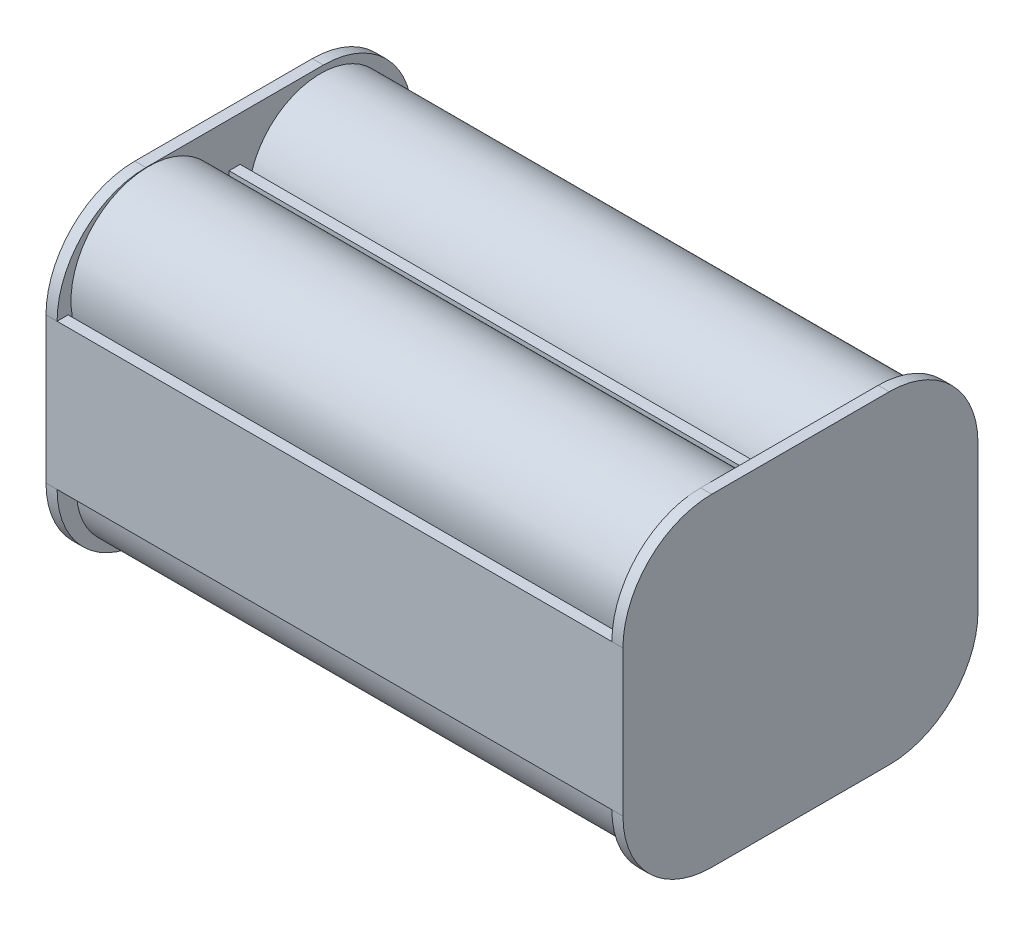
SolidWorks part; units mm, degrees
ref_plane "Plano frontal" through (0, 0, 0) normal (0, 0, 1) x (1, 0, 0)
ref_plane "Plano superior" through (0, 0, 0) normal (0, 1, 0) x (1, 0, 0)
ref_plane "Plano direito" through (0, 0, 0) normal (1, 0, 0) x (0, 0, -1)
sketch "Esboço1" plane through (0, 0, 0) normal (1, 0, 0) x (0, 0, -1)
  line L1 (-5.3034, 18.6966) -> (10.6966, 18.6966)
  line L2 (-13.3034, 10.6966) -> (-13.3034, -2.427)
  line L3 (-5.3034, -10.427) -> (10.6966, -10.427)
  line L4 (18.6966, 10.6966) -> (18.6966, -2.427)
  arc A0 (-5.3034, 18.6966) -> (-13.3034, 10.6966) centre (-5.3034, 10.6966) ccw
  arc A1 (10.6966, 18.6966) -> (18.6966, 10.6966) centre (10.6966, 10.6966) cw
  arc A2 (10.6966, -10.427) -> (18.6966, -2.427) centre (10.6966, -2.427) ccw
  arc A3 (-13.3034, -2.427) -> (-5.3034, -10.427) centre (-5.3034, -2.427) ccw
  point P4 (-13.3034, 4.1348)
  point P5 (18.6966, 4.1348)
  point P8 (-13.3034, 18.6966)
  point P11 (18.6966, 18.6966)
  point P16 (-13.3034, -10.427)
  dimension "D3" = 8
  dimension "D4" = 8
  dimension "D5" = 8
  dimension "D6" = 8
  dimension "D1" = 32
  dimension "D2" = 29.1236
extrude "Ressalto-extrusão1" add sketch "Esboço1" along normal blind 1
sketch "Esboço2" plane through (1, 0, 0) normal (1, 0, 0) x (0, 0, -1)
  line L0 (-5.3034, -10.427) -> (10.6966, -10.427) construction
  line L1 (-13.3034, 10.6966) -> (-13.3034, -2.427) construction
  line L2 (18.6966, -2.427) -> (18.6966, 10.6966) construction
  line L3 (18.6966, 4.1348) -> (18.6966, 4.6348)
  line L4 (17.6966, 4.6348) -> (3.1966, 4.6348)
  line L5 (-13.3034, 4.6348) -> (-13.3034, 3.6348)
  line L6 (-12.3034, 3.6348) -> (2.1966, 3.6348)
  line L7 (3.1966, -6.427) -> (3.1966, 3.6348)
  line L8 (10.6966, 18.6966) -> (-5.3034, 18.6966) construction
  line L9 (3.1966, 18.6966) -> (2.1966, 18.6966)
  line L10 (2.1966, 14.6966) -> (2.1966, 4.6348)
  line L11 (2.6966, 14.6966) -> (3.1966, 14.6966)
  line L12 (3.1966, 14.6966) -> (2.1966, 14.6966)
  line L13 (2.1966, -6.427) -> (3.1966, -6.427)
  line L14 (18.6966, -2.427) -> (17.6966, -2.427)
  line L15 (17.6966, -2.427) -> (17.6966, 3.6348)
  line L16 (17.6966, 10.6966) -> (18.6966, 10.6966)
  line L17 (-13.3034, -2.427) -> (-12.3034, -2.427)
  line L18 (-12.3034, -2.427) -> (-12.3034, 3.6348)
  line L19 (-12.3034, 10.6966) -> (-13.3034, 10.6966)
  line L20 (-12.3034, 4.6348) -> (-12.3034, 10.6966)
  line L21 (2.1966, 4.6348) -> (-12.3034, 4.6348)
  line L22 (3.1966, 3.6348) -> (17.6966, 3.6348)
  line L23 (2.1966, 3.6348) -> (2.1966, -6.427)
  line L24 (3.1966, 4.6348) -> (3.1966, 14.6966)
  line L25 (17.6966, 4.6348) -> (17.6966, 10.6966)
  arc A0 (-5.3034, 18.6966) -> (-13.3034, 10.6966) centre (-5.3034, 10.6966) ccw construction
  point P0 (2.6966, -10.427)
  point P6 (18.6966, 3.6348)
  point P9 (3.1966, -10.427)
  point P14 (2.1966, -10.427)
  point P15 (2.6966, -6.427)
  point P20 (2.6966, 14.6966)
  point P28 (18.6966, -2.427)
  point P29 (17.6966, -2.427)
  point P33 (-13.3034, -2.427)
  point P37 (-12.3034, -2.427)
  dimension "D1" = 0.5
  dimension "D2" = 0.5
  dimension "D3" = 0.5
  dimension "D4" = 0.5
  dimension "D5" = 4
  dimension "D6" = 4
  dimension "D7" = 1
  dimension "D8" = 1
extrude "Ressalto-extrusão2" add sketch "Esboço2" along normal blind 50 contours L25 L4 L24 L11 L12 L10 L21 L20 L19 L17 L18 L6 L23 L13 L7 L22 L15 L14 L16 M2 M6
sketch "Esboço3" plane through (1, 0, 0) normal (1, 0, 0) x (0, 0, -1)
  line L0 (-5.0534, 4.6348) -> (-5.0534, 4.6657)
  line L1 (2.1966, 4.6348) -> (-12.3034, 4.6348) construction
  line L2 (10.6966, 18.6966) -> (-5.3034, 18.6966) construction
  line L10 (-5.0534, 18.6657) -> (-5.0534, 18.6966)
  circle A0 centre (-5.0534, 11.6657) radius 7
  circle A1 centre (10.4466, 11.6657) radius 7.0309
  circle A2 centre (10.4466, -3.3961) radius 7.0309
  circle A3 centre (-5.0534, -3.3961) radius 7.0309
  point P20 (-5.0534, 11.6657)
  point P21 (10.4466, 11.6657)
  point P22 (10.4466, -3.3961)
  point P23 (-5.0534, -3.3961)
  dimension "D1" = 14
extrude "Ressalto-extrusão5" add sketch "Esboço3" along normal blind 50 contours A0 M11
sketch "Esboço7" plane through (1, 0, 0) normal (1, 0, 0) x (0, 0, -1)
  circle A0 centre (10.4466, 11.6657) radius 6.5
  dimension "D1" = 13
extrude "Ressalto-extrusão9" add sketch "Esboço7" along normal blind 50
sketch "Esboço8" plane through (1, 0, 0) normal (1, 0, 0) x (0, 0, -1)
  circle A0 centre (-5.0534, -3.3961) radius 6.5
  dimension "D1" = 13
extrude "Ressalto-extrusão10" add sketch "Esboço8" along normal blind 50
sketch "Esboço9" plane through (1, 0, 0) normal (1, 0, 0) x (0, 0, -1)
  circle A0 centre (10.4466, -3.3961) radius 6.5
  dimension "D1" = 13
extrude "Ressalto-extrusão11" add sketch "Esboço9" along normal blind 50
sketch "Esboço10" plane through (51, 0, 0) normal (1, 0, 0) x (0, 0, -1)
  line L0 (3.1966, 4.6348) -> (2.1966, 3.6348)
  line L2 (-5.3034, -10.427) -> (10.6966, -10.427)
  line L3 (-13.3034, -2.427) -> (-13.3034, 10.6966)
  line L4 (-5.3034, 18.6966) -> (10.6966, 18.6966)
  line L5 (18.6966, -2.427) -> (18.6966, 10.6966)
  line L6 (-13.3034, -10.427) -> (18.6966, 18.6966) construction
  line L7 (-13.3034, 18.6966) -> (18.6966, -10.427) construction
  arc A0 (-13.3034, 10.6966) -> (-5.3034, 18.6966) centre (-5.3034, 10.6966) cw
  arc A1 (10.6966, 18.6966) -> (18.6966, 10.6966) centre (10.6966, 10.6966) cw
  arc A2 (10.6966, -10.427) -> (18.6966, -2.427) centre (10.6966, -2.427) ccw
  arc A3 (-5.3034, -10.427) -> (-13.3034, -2.427) centre (-5.3034, -2.427) cw
  point P0 (2.1966, 3.6348)
  point P1 (3.1966, 4.6348)
  point P7 (2.6966, 4.1348)
  point P8 (2.6966, 4.1348)
  dimension "D1" = 8
  dimension "D2" = 8
  dimension "D3" = 8
  dimension "D4" = 8
extrude "Ressalto-extrusão12" add sketch "Esboço10" along normal blind 1 contours A0 L4 A1 L5 A2 L2 A3 L3
